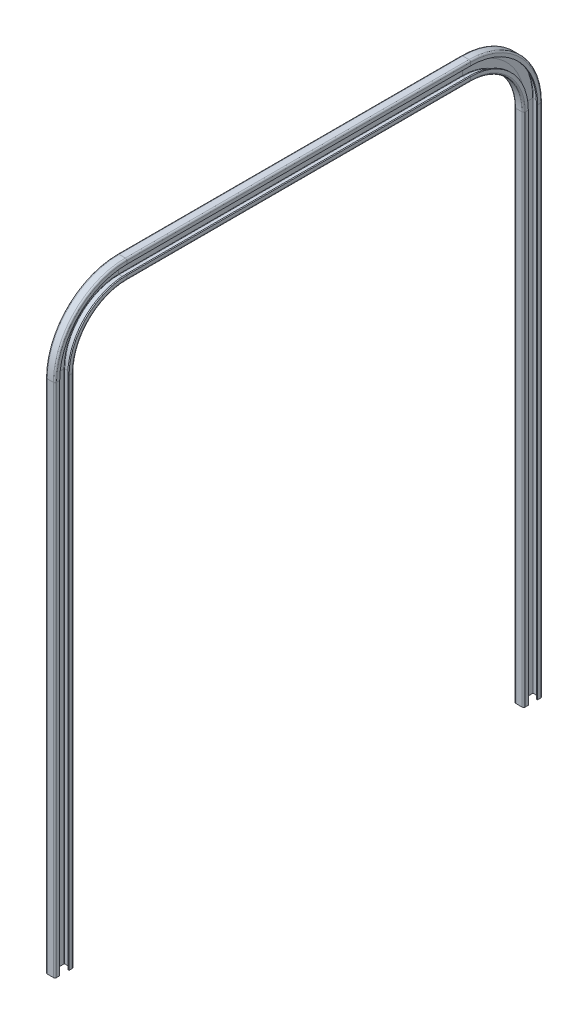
SolidWorks part; units mm, degrees
ref_plane "Vorne" through (0, 0, 0) normal (0, 0, 1) x (1, 0, 0)
ref_plane "Oben" through (0, 0, 0) normal (0, 1, 0) x (1, 0, 0)
ref_plane "Rechts" through (0, 0, 0) normal (1, 0, 0) x (0, 0, -1)
sketch "Skizze1" plane through (0, 0, 0) normal (0, 1, 0) x (1, 0, 0)
  line L0 (0, 0) -> (0, -25)
  line L1 (5, -30) -> (25, -30)
  line L2 (30, -25) -> (30, -15)
  line L3 (30, -15) -> (26, -15)
  line L4 (26, -15) -> (26, -25)
  line L5 (25, -26) -> (5, -26)
  line L6 (4, -25) -> (4, 0)
  line L7 (4, 0) -> (0, 0) construction
  line L8 (4, 0) -> (26, 0) construction
  line L9 (26, 0) -> (26, -15) construction
  line L10 (0, 0) -> (0, 25)
  line L11 (5, 30) -> (25, 30)
  line L12 (30, 25) -> (30, 15)
  line L13 (30, 15) -> (26, 15)
  line L14 (26, 15) -> (26, 25)
  line L15 (25, 26) -> (5, 26)
  line L16 (4, 25) -> (4, 0)
  arc A0 (25, -30) -> (30, -25) centre (25, -25) ccw
  arc A1 (0, -25) -> (5, -30) centre (5, -25) ccw
  arc A2 (26, -25) -> (25, -26) centre (25, -25) cw
  arc A3 (5, -26) -> (4, -25) centre (5, -25) cw
  arc A4 (0, 25) -> (5, 30) centre (5, 25) cw
  arc A5 (25, 30) -> (30, 25) centre (25, 25) cw
  arc A6 (26, 25) -> (25, 26) centre (25, 25) ccw
  arc A7 (5, 26) -> (4, 25) centre (5, 25) ccw
  point P12 (30, -30)
  point P15 (0, -30)
  dimension "D5" = 5
  dimension "D1" = 30
  dimension "D2" = 30
  dimension "D3" = 30
  dimension "D4" = 4
sketch "Skizze2" plane through (0, 0, 0) normal (1, 0, 0) x (0, 0, -1)
  line L0 (0, 0) -> (0, 1650)
  line L1 (200, 1850) -> (1300, 1850)
  line L2 (1500, 1650) -> (1500, 0)
  arc A0 (0, 1650) -> (200, 1850) centre (200, 1650) cw
  arc A1 (1300, 1850) -> (1500, 1650) centre (1300, 1650) cw
  dimension "D1" = 1500
  dimension "D3" = 200
  dimension "D2" = 1850
sweep "Austragung1" add profiles "Skizze1" path "Skizze2"
